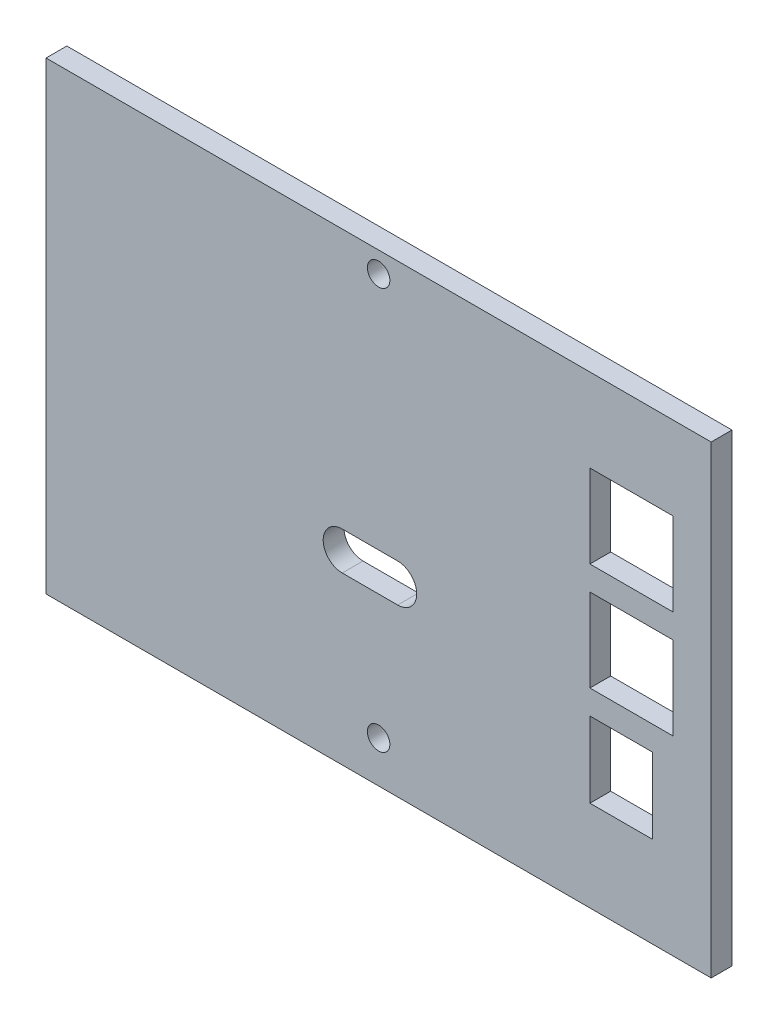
SolidWorks part; units mm, degrees
ref_plane "Alzado" through (0, 0, 0) normal (0, 0, 1) x (1, 0, 0)
ref_plane "Planta" through (0, 0, 0) normal (0, 1, 0) x (1, 0, 0)
ref_plane "Vista lateral" through (0, 0, 0) normal (1, 0, 0) x (0, 0, -1)
sketch "Croquis6" plane through (0, 0, 0) normal (0, 0, 1) x (1, 0, 0)
  line L1 (-48, -33.5) -> (48, -33.5)
  line L2 (-48, -33.5) -> (-48, 33.5)
  line L3 (-48, 33.5) -> (48, 33.5)
  line L4 (48, -33.5) -> (48, 33.5)
  line L5 (-48, -33.5) -> (48, 33.5) construction
  line L6 (-48, 33.5) -> (48, -33.5) construction
  point P0 (0, 0)
  dimension "D1" = 96
  dimension "D2" = 67
extrude "Saliente-Extruir1" add sketch "Croquis6" along normal blind 3
sketch "Croquis7" plane through (0, 0, 0) normal (0, 0, 1) x (1, 0, 0)
  line L0 (48, 33.5) -> (-48, 33.5) construction
  line L1 (42.5, 21.5) -> (30.5, 21.5)
  line L2 (42.5, 21.5) -> (42.5, 9.5)
  line L3 (42.5, 9.5) -> (30.5, 9.5)
  line L4 (30.5, 21.5) -> (30.5, 9.5)
  line L5 (42.5, 21.5) -> (30.5, 9.5) construction
  line L6 (42.5, 9.5) -> (30.5, 21.5) construction
  line L7 (42.5, 6) -> (30.5, 6)
  line L8 (42.5, 6) -> (42.5, -6)
  line L9 (42.5, -6) -> (30.5, -6)
  line L10 (30.5, 6) -> (30.5, -6)
  line L11 (42.5, 6) -> (30.5, -6) construction
  line L12 (42.5, -6) -> (30.5, 6) construction
  line L13 (-48, -33.5) -> (48, -33.5) construction
  line L14 (30.5, -9.5) -> (39.5, -9.5)
  line L15 (30.5, -9.5) -> (30.5, -20.4)
  line L16 (30.5, -20.4) -> (39.5, -20.4)
  line L17 (39.5, -9.5) -> (39.5, -20.4)
  line L18 (30.5, -9.5) -> (39.5, -20.4) construction
  line L19 (30.5, -20.4) -> (39.5, -9.5) construction
  line L20 (-48, 33.5) -> (-48, -33.5) construction
  line L21 (2.75, -6.75) -> (-5.25, -6.75) construction
  line L22 (2.75, -9.5) -> (-5.25, -9.5)
  line L23 (2.75, -4) -> (-5.25, -4)
  arc A0 (2.75, -9.5) -> (2.75, -4) centre (2.75, -6.75) ccw
  arc A1 (-5.25, -4) -> (-5.25, -9.5) centre (-5.25, -6.75) ccw
  circle A2 centre (0, -27.5) radius 1.625 construction
  circle A3 centre (0, 30.5) radius 1.625 construction
  circle A4 centre (0, -27.5) radius 1.625
  circle A5 centre (0, 30.5) radius 1.625
  point P0 (36.5, 15.5)
  point P7 (36.5, 0)
  point P12 (35, -14.95)
  point P23 (-1.25, -6.75)
  dimension "D11" = 42.75
  dimension "D1" = 12
  dimension "D2" = 12
  dimension "D3" = 12
  dimension "D4" = 3.5
  dimension "D5" = 10.9
  dimension "D6" = 9
  dimension "D7" = 24
  dimension "D8" = 87.5
  dimension "D9" = 8
  dimension "D10" = 5.5
  dimension ".5" = 29.5
extrude "Cortar-Extruir1" cut sketch "Croquis7" along normal through all
sketch "Sketch2" plane through (0, 0, 0) normal (0, 0, -1) x (-1, 0, 0)
  line L0 (-22.3953, -15.6143) -> (-23.5233, -15.6143)
  line L1 (-23.5233, -15.6143) -> (-23.5674, -15.5581)
  line L2 (-19.4787, 8.6388) -> (-15.3523, 8.6388)
  line L3 (-15.3523, 8.6388) -> (-15.1858, 8.5864)
  line L4 (-21.8357, 11.4405) -> (-21.5268, 11.0068)
  line L5 (-21.5268, 11.0068) -> (-19.2367, 10.9951)
  line L6 (-16.4, 9.899) -> (-16.3926, 9.3305)
  line L7 (-16.3926, 9.3305) -> (-20.1278, 9.33)
  spline S0 degree 3 poles (-22.9243, -15.6196) (-22.6224, -15.6163) (-22.1285, -15.6163) (-21.8267, -15.6196) knots 0 0 0 0 1 1 1 1
  spline S1 degree 3 poles (-21.8267, -15.6196) (-21.5249, -15.623) (-21.7718, -15.6257) (-22.3755, -15.6257) knots 0 0 0 0 1 1 1 1
  spline S2 degree 3 poles (-22.3755, -15.6257) (-22.9792, -15.6257) (-23.2261, -15.623) (-22.9243, -15.6196) knots 0 0 0 0 1 1 1 1
  spline S3 degree 3 poles (-19.2038, -13.4031) (-18.907, -13.3998) (-18.4274, -13.3998) (-18.1381, -13.4032) knots 0 0 0 0 1 1 1 1
  spline S4 degree 3 poles (-18.1381, -13.4032) (-17.8488, -13.4065) (-18.0917, -13.4092) (-18.6778, -13.4092) knots 0 0 0 0 1 1 1 1
  spline S5 degree 3 poles (-18.6778, -13.4092) (-19.2639, -13.4092) (-19.5006, -13.4065) (-19.2038, -13.4031) knots 0 0 0 0 1 1 1 1
  spline S6 degree 3 poles (-22.6632, -20.3902) (-22.7403, -20.3574) (-22.7901, -20.2823) (-22.7895, -20.2001) knots 0 0 0 0 1 1 1 1
  spline S7 degree 3 poles (-22.7895, -20.2001) (-22.7891, -20.1548) (-22.4693, -19.1802) (-22.0281, -17.8797) knots 0 0 0 0 1 1 1 1
  spline S8 degree 3 poles (-22.0281, -17.8797) (-21.6096, -16.6465) (-21.2672, -15.6323) (-21.2672, -15.6259) knots 0 0 0 0 1 1 1 1
  spline S9 degree 3 poles (-21.2672, -15.6259) (-21.2672, -15.6195) (-21.7748, -15.6143) (-22.3953, -15.6143) knots 0 0 0 0 1 1 1 1
  spline S10 degree 3 poles (-23.5674, -15.5581) (-23.594, -15.5243) (-23.6114, -15.4713) (-23.611, -15.4249) knots 0 0 0 0 1 1 1 1
  spline S11 degree 3 poles (-23.611, -15.4249) (-23.6102, -15.3094) (-20.897, -9.616) (-20.8128, -9.5532) knots 0 0 0 0 1 1 1 1
  spline S12 degree 3 poles (-20.8128, -9.5532) (-20.7532, -9.5087) (-20.7398, -9.5082) (-19.2946, -9.5025) knots 0 0 0 0 1 1 1 1
  spline S13 degree 3 poles (-19.2946, -9.5025) (-17.7109, -9.4963) (-17.7314, -9.4949) (-17.6541, -9.6129) knots 0 0 0 0 1 1 1 1
  spline S14 degree 3 poles (-17.6541, -9.6129) (-17.6323, -9.6461) (-17.6214, -9.6952) (-17.6266, -9.7372) knots 0 0 0 0 1 1 1 1
  spline S15 degree 3 poles (-17.6266, -9.7372) (-17.6317, -9.7798) (-18.0406, -10.5003) (-18.6839, -11.6006) knots 0 0 0 0 1 1 1 1
  spline S16 degree 3 poles (-18.6839, -11.6006) (-19.2608, -12.5872) (-19.7327, -13.4) (-19.7327, -13.4068) knots 0 0 0 0 1 1 1 1
  spline S17 degree 3 poles (-19.7327, -13.4068) (-19.7327, -13.4136) (-19.243, -13.4191) (-18.6444, -13.4191) knots 0 0 0 0 1 1 1 1
  spline S18 degree 3 poles (-18.6444, -13.4191) (-17.8848, -13.4191) (-17.542, -13.4263) (-17.5095, -13.4429) knots 0 0 0 0 1 1 1 1
  spline S19 degree 3 poles (-17.5095, -13.4429) (-17.4314, -13.4829) (-17.3893, -13.5526) (-17.3889, -13.6429) knots 0 0 0 0 1 1 1 1
  spline S20 degree 3 poles (-17.3889, -13.6429) (-17.3886, -13.7233) (-17.5302, -13.915) (-19.8834, -17.0209) knots 0 0 0 0 1 1 1 1
  spline S21 degree 3 poles (-19.8834, -17.0209) (-21.2556, -18.832) (-22.3993, -20.3296) (-22.4251, -20.3491) knots 0 0 0 0 1 1 1 1
  spline S22 degree 3 poles (-22.4251, -20.3491) (-22.4832, -20.393) (-22.6065, -20.4143) (-22.6632, -20.3902) knots 0 0 0 0 1 1 1 1
  spline S23 degree 3 poles (-25.9777, 3.1376) (-26.142, 3.1945) (-26.2792, 3.2933) (-26.3632, 3.4154) knots 0 0 0 0 1 1 1 1
  spline S24 degree 3 poles (-26.3632, 3.4154) (-26.5125, 3.6324) (-26.6003, 3.4029) (-25.4214, 5.8752) knots 0 0 0 0 1 1 1 1
  spline S25 degree 3 poles (-25.4214, 5.8752) (-24.8388, 7.0969) (-24.338, 8.1341) (-24.3084, 8.1801) knots 0 0 0 0 1 1 1 1
  spline S26 degree 3 poles (-24.3084, 8.1801) (-24.2422, 8.2831) (-24.0782, 8.4394) (-23.9685, 8.5042) knots 0 0 0 0 1 1 1 1
  spline S27 degree 3 poles (-23.9685, 8.5042) (-23.9233, 8.5308) (-23.8231, 8.572) (-23.7457, 8.5957) knots 0 0 0 0 1 1 1 1
  spline S28 degree 3 poles (-23.7457, 8.5957) (-23.6115, 8.6369) (-23.4176, 8.6388) (-19.4787, 8.6388) knots 0 0 0 0 1 1 1 1
  spline S29 degree 3 poles (-15.1858, 8.5864) (-14.7125, 8.4375) (-14.4218, 7.963) (-14.5185, 7.4971) knots 0 0 0 0 1 1 1 1
  spline S30 degree 3 poles (-14.5185, 7.4971) (-14.56, 7.2975) (-16.4254, 3.5665) (-16.559, 3.416) knots 0 0 0 0 1 1 1 1
  spline S31 degree 3 poles (-16.559, 3.416) (-16.6765, 3.2836) (-16.8139, 3.1986) (-17.0082, 3.1381) knots 0 0 0 0 1 1 1 1
  spline S32 degree 3 poles (-17.0082, 3.1381) (-17.145, 3.0955) (-17.3041, 3.094) (-21.5029, 3.0947) knots 0 0 0 0 1 1 1 1
  spline S33 degree 3 poles (-21.5029, 3.0947) (-25.6297, 3.0955) (-25.8621, 3.0977) (-25.9777, 3.1376) knots 0 0 0 0 1 1 1 1
  spline S34 degree 3 poles (-26.4996, 8.488) (-26.5006, 12.1006) (-26.5089, 11.8964) (-26.3527, 12.1012) knots 0 0 0 0 1 1 1 1
  spline S35 degree 3 poles (-26.3527, 12.1012) (-26.251, 12.2346) (-26.1169, 12.3255) (-25.9607, 12.3671) knots 0 0 0 0 1 1 1 1
  spline S36 degree 3 poles (-25.9607, 12.3671) (-25.7684, 12.4183) (-22.9155, 12.4181) (-22.719, 12.3669) knots 0 0 0 0 1 1 1 1
  spline S37 degree 3 poles (-22.719, 12.3669) (-22.4562, 12.2984) (-22.4189, 12.2594) (-21.8357, 11.4405) knots 0 0 0 0 1 1 1 1
  spline S38 degree 3 poles (-19.2367, 10.9951) (-16.9513, 10.9834) (-16.9464, 10.9833) (-16.837, 10.9327) knots 0 0 0 0 1 1 1 1
  spline S39 degree 3 poles (-16.837, 10.9327) (-16.6901, 10.8648) (-16.5355, 10.7184) (-16.4651, 10.5805) knots 0 0 0 0 1 1 1 1
  spline S40 degree 3 poles (-16.4651, 10.5805) (-16.4092, 10.4712) (-16.4071, 10.4496) (-16.4, 9.899) knots 0 0 0 0 1 1 1 1
  spline S41 degree 3 poles (-20.1278, 9.33) (-22.5099, 9.3298) (-23.9224, 9.321) (-24.027, 9.3059) knots 0 0 0 0 1 1 1 1
  spline S42 degree 3 poles (-24.027, 9.3059) (-24.3946, 9.253) (-24.6546, 9.0527) (-24.8344, 8.6837) knots 0 0 0 0 1 1 1 1
  spline S43 degree 3 poles (-24.8344, 8.6837) (-24.8905, 8.5688) (-25.273, 7.7687) (-25.6846, 6.9057) knots 0 0 0 0 1 1 1 1
  spline S44 degree 3 poles (-25.6846, 6.9057) (-26.0962, 6.0427) (-26.4477, 5.3095) (-26.4658, 5.2762) knots 0 0 0 0 1 1 1 1
  spline S45 degree 3 poles (-26.4658, 5.2762) (-26.4941, 5.2241) (-26.4988, 5.6683) (-26.4996, 8.488) knots 0 0 0 0 1 1 1 1
  spline S46 degree 3 poles (-20.7346, -5.9526) (-20.8169, -5.9156) (-21.4485, -5.2974) (-23.604, -3.1439) knots 0 0 0 0 1 1 1 1
  spline S47 degree 3 poles (-23.604, -3.1439) (-25.1241, -1.6252) (-26.3935, -0.3395) (-26.4249, -0.2868) knots 0 0 0 0 1 1 1 1
  spline S48 degree 3 poles (-26.4249, -0.2868) (-26.5549, -0.0685) (-26.5133, 0.2105) (-26.3223, 0.4006) knots 0 0 0 0 1 1 1 1
  spline S49 degree 3 poles (-26.3223, 0.4006) (-26.2555, 0.4671) (-26.1743, 0.5214) (-26.1157, 0.5389) knots 0 0 0 0 1 1 1 1
  spline S50 degree 3 poles (-26.1157, 0.5389) (-26.0408, 0.5611) (-24.7804, 0.5676) (-20.5, 0.5676) knots 0 0 0 0 1 1 1 1
  spline S51 degree 3 poles (-20.5, 0.5676) (-16.2196, 0.5676) (-14.9592, 0.5616) (-14.8843, 0.5389) knots 0 0 0 0 1 1 1 1
  spline S52 degree 3 poles (-14.8843, 0.5389) (-14.8257, 0.5215) (-14.7445, 0.4672) (-14.6777, 0.4006) knots 0 0 0 0 1 1 1 1
  spline S53 degree 3 poles (-14.6777, 0.4006) (-14.4867, 0.2105) (-14.4451, -0.0685) (-14.5752, -0.2868) knots 0 0 0 0 1 1 1 1
  spline S54 degree 3 poles (-14.5752, -0.2868) (-14.6065, -0.3395) (-15.8759, -1.6252) (-17.396, -3.1439) knots 0 0 0 0 1 1 1 1
  spline S55 degree 3 poles (-17.396, -3.1439) (-19.5515, -5.2974) (-20.1831, -5.9156) (-20.2654, -5.9526) knots 0 0 0 0 1 1 1 1
  spline S56 degree 3 poles (-20.2654, -5.9526) (-20.3301, -5.9816) (-20.421, -6) (-20.5, -6) knots 0 0 0 0 1 1 1 1
  spline S57 degree 3 poles (-20.5, -6) (-20.579, -6) (-20.6699, -5.9816) (-20.7346, -5.9526) knots 0 0 0 0 1 1 1 1
  spline S58 degree 3 poles (-20.7346, 21.4526) (-20.8169, 21.4156) (-21.4485, 20.7974) (-23.604, 18.6439) knots 0 0 0 0 1 1 1 1
  spline S59 degree 3 poles (-23.604, 18.6439) (-25.1241, 17.1252) (-26.3935, 15.8395) (-26.4249, 15.7868) knots 0 0 0 0 1 1 1 1
  spline S60 degree 3 poles (-26.4249, 15.7868) (-26.5549, 15.5685) (-26.5133, 15.2895) (-26.3223, 15.0994) knots 0 0 0 0 1 1 1 1
  spline S61 degree 3 poles (-26.3223, 15.0994) (-26.2555, 15.0329) (-26.1743, 14.9786) (-26.1157, 14.9611) knots 0 0 0 0 1 1 1 1
  spline S62 degree 3 poles (-26.1157, 14.9611) (-26.0408, 14.9389) (-24.7804, 14.9325) (-20.5, 14.9325) knots 0 0 0 0 1 1 1 1
  spline S63 degree 3 poles (-20.5, 14.9325) (-16.2196, 14.9325) (-14.9592, 14.9389) (-14.8843, 14.9611) knots 0 0 0 0 1 1 1 1
  spline S64 degree 3 poles (-14.8843, 14.9611) (-14.8257, 14.9785) (-14.7445, 15.0329) (-14.6777, 15.0994) knots 0 0 0 0 1 1 1 1
  spline S65 degree 3 poles (-14.6777, 15.0994) (-14.4867, 15.2895) (-14.4451, 15.5685) (-14.5752, 15.7868) knots 0 0 0 0 1 1 1 1
  spline S66 degree 3 poles (-14.5752, 15.7868) (-14.6065, 15.8395) (-15.8759, 17.1252) (-17.396, 18.6439) knots 0 0 0 0 1 1 1 1
  spline S67 degree 3 poles (-17.396, 18.6439) (-19.5515, 20.7974) (-20.1831, 21.4156) (-20.2654, 21.4526) knots 0 0 0 0 1 1 1 1
  spline S68 degree 3 poles (-20.2654, 21.4526) (-20.3301, 21.4816) (-20.421, 21.5) (-20.5, 21.5) knots 0 0 0 0 1 1 1 1
  spline S69 degree 3 poles (-20.5, 21.5) (-20.579, 21.5) (-20.6699, 21.4816) (-20.7346, 21.4526) knots 0 0 0 0 1 1 1 1
sketch "Sketch3" plane through (0, 0, 0) normal (0, 0, -1) x (-1, 0, 0)
  line L0 (0.3471, -0.1213) -> (0.4863, 0.0193)
  line L1 (0.4863, 0.0193) -> (-0.8214, 1.3302)
  line L2 (-2.1938, 4.0023) -> (-2.1938, 5.2355)
  line L3 (-2.1938, 5.2355) -> (-2.305, 5.3057)
  line L4 (-1.1344, 5.3242) -> (-1.2539, 5.2509)
  line L5 (-1.2539, 5.2509) -> (-1.2538, 4.1659)
  line L6 (-1.2538, 4.1659) -> (-1.2537, 3.0809)
  line L7 (-1.2537, 3.0809) -> (-0.2805, 2.0692)
  line L8 (0.7386, 5.1898) -> (0.7386, 9.3416)
  line L9 (0.7386, 9.3416) -> (0.366, 9.6084)
  line L10 (2.1031, 9.6083) -> (1.6769, 9.3415)
  line L11 (1.6769, 9.3415) -> (1.6769, 6.2748)
  line L12 (1.6769, 6.2748) -> (1.6769, 3.2081)
  line L13 (1.6769, 3.2081) -> (2.7326, 4.2436)
  line L14 (2.7326, 4.2436) -> (3.7882, 5.2791)
  line L15 (3.7882, 5.2791) -> (3.7882, 6.0201)
  line L16 (3.7882, 6.0201) -> (3.7882, 6.761)
  line L17 (3.7882, 6.761) -> (3.5517, 6.761)
  line L18 (3.2018, 7.7887) -> (3.2018, 8.7558)
  line L19 (3.2018, 8.7558) -> (4.2501, 8.7478)
  line L20 (4.2501, 8.7478) -> (5.2984, 8.7398)
  line L21 (5.2984, 8.7398) -> (5.3064, 7.7789)
  line L22 (5.3064, 7.7789) -> (5.3144, 6.8179)
  line L23 (5.3144, 6.8179) -> (5.2388, 6.7892)
  line L24 (4.9452, 6.7605) -> (4.7272, 6.7605)
  line L25 (4.7272, 6.7605) -> (4.7272, 5.9092)
  line L26 (3.1572, 3.3794) -> (1.6775, 1.9169)
  line L27 (1.6775, 1.9169) -> (1.6775, 1.0456)
  line L28 (1.6775, 1.0456) -> (1.6775, 0.1743)
  line L29 (1.6775, 0.1743) -> (1.8112, 0.1093)
  line L30 (1.0062, -2.2401) -> (1.0057, -2.239)
  spline S0 degree 3 poles (1.0057, -2.239) (0.7865, -2.196) (0.5245, -2.0539) (0.3588, -1.8881) knots 0 0 0 0 1 1 1 1
  spline S1 degree 3 poles (0.3588, -1.8881) (-0.1277, -1.4016) (-0.133, -0.6065) (0.3471, -0.1213) knots 0 0 0 0 1 1 1 1
  spline S2 degree 3 poles (-0.8214, 1.3302) (-1.5406, 2.0512) (-2.1436, 2.6699) (-2.1614, 2.7051) knots 0 0 0 0 1 1 1 1
  spline S3 degree 3 poles (-2.1614, 2.7051) (-2.1835, 2.7488) (-2.1938, 3.1607) (-2.1938, 4.0023) knots 0 0 0 0 1 1 1 1
  spline S4 degree 3 poles (-2.305, 5.3057) (-2.5818, 5.4804) (-2.762, 5.8041) (-2.7641, 6.1306) knots 0 0 0 0 1 1 1 1
  spline S5 degree 3 poles (-2.7641, 6.1306) (-2.7661, 6.3924) (-2.7166, 6.5594) (-2.5789, 6.7593) knots 0 0 0 0 1 1 1 1
  spline S6 degree 3 poles (-2.5789, 6.7593) (-2.151, 7.3807) (-1.216, 7.332) (-0.8365, 6.6686) knots 0 0 0 0 1 1 1 1
  spline S7 degree 3 poles (-0.8365, 6.6686) (-0.5765, 6.2142) (-0.717, 5.5802) (-1.1344, 5.3242) knots 0 0 0 0 1 1 1 1
  spline S8 degree 3 poles (-0.2805, 2.0692) (0.2548, 1.5128) (0.7031, 1.0532) (0.7157, 1.0478) knots 0 0 0 0 1 1 1 1
  spline S9 degree 3 poles (0.7157, 1.0478) (0.7283, 1.0428) (0.7386, 2.9063) (0.7386, 5.1898) knots 0 0 0 0 1 1 1 1
  spline S10 degree 3 poles (0.366, 9.6084) (-0.0422, 9.6084) (-0.1161, 9.6313) (-0.1161, 9.7578) knots 0 0 0 0 1 1 1 1
  spline S11 degree 3 poles (-0.1161, 9.7578) (-0.1161, 9.7971) (0.1643, 10.522) (0.5069, 11.3684) knots 0 0 0 0 1 1 1 1
  spline S12 degree 3 poles (0.5069, 11.3684) (0.8496, 12.2148) (1.1361, 12.9233) (1.1438, 12.9428) knots 0 0 0 0 1 1 1 1
  spline S13 degree 3 poles (1.1438, 12.9428) (1.1658, 12.9995) (1.2718, 13.0203) (1.3144, 12.9762) knots 0 0 0 0 1 1 1 1
  spline S14 degree 3 poles (1.3144, 12.9762) (1.3631, 12.9259) (2.6184, 9.8224) (2.6184, 9.7524) knots 0 0 0 0 1 1 1 1
  spline S15 degree 3 poles (2.6184, 9.7524) (2.6184, 9.6277) (2.5491, 9.6083) (2.1031, 9.6083) knots 0 0 0 0 1 1 1 1
  spline S16 degree 3 poles (3.5517, 6.761) (3.1693, 6.761) (3.2018, 6.6657) (3.2018, 7.7887) knots 0 0 0 0 1 1 1 1
  spline S17 degree 3 poles (5.2388, 6.7892) (5.1972, 6.7734) (5.0651, 6.7605) (4.9452, 6.7605) knots 0 0 0 0 1 1 1 1
  spline S18 degree 3 poles (4.7272, 5.9092) (4.7272, 5.2092) (4.7192, 5.0386) (4.6821, 4.9499) knots 0 0 0 0 1 1 1 1
  spline S19 degree 3 poles (4.6821, 4.9499) (4.6511, 4.8755) (4.1757, 4.386) (3.1572, 3.3794) knots 0 0 0 0 1 1 1 1
  spline S20 degree 3 poles (1.8112, 0.1093) (2.0985, -0.0302) (2.3701, -0.3691) (2.4573, -0.6967) knots 0 0 0 0 1 1 1 1
  spline S21 degree 3 poles (2.4573, -0.6967) (2.641, -1.3866) (2.1812, -2.1075) (1.4716, -2.2421) knots 0 0 0 0 1 1 1 1
  spline S22 degree 3 poles (1.4716, -2.2421) (1.2944, -2.2757) (1.1872, -2.2751) (1.0062, -2.2401) knots 0 0 0 0 1 1 1 1
